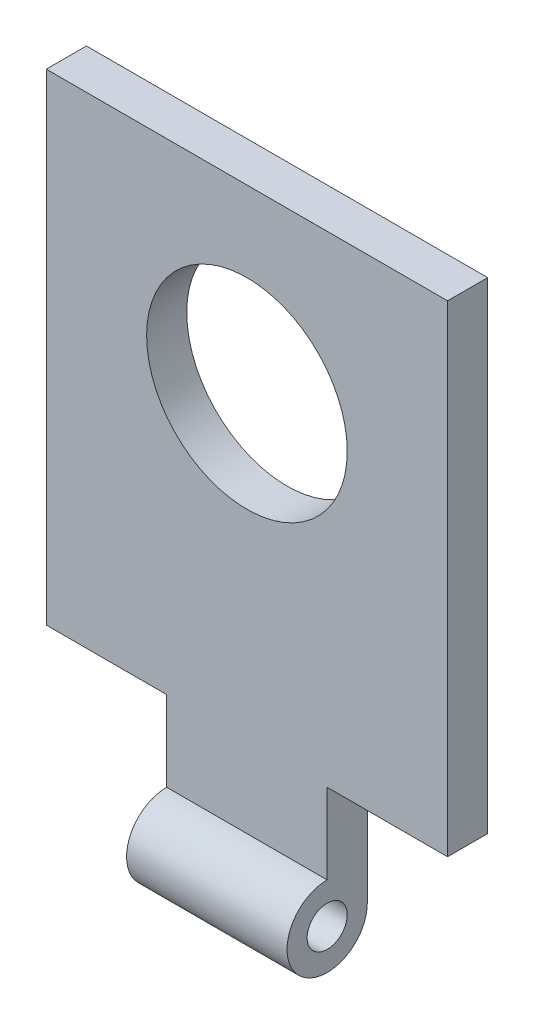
SolidWorks part; units mm, degrees
ref_plane "Plan de face" through (0, 0, 0) normal (0, 0, 1) x (1, 0, 0)
ref_plane "Plan de dessus" through (0, 0, 0) normal (0, 1, 0) x (1, 0, 0)
ref_plane "Plan de droite" through (0, 0, 0) normal (1, 0, 0) x (0, 0, -1)
sketch "Esquisse1" plane through (0, 0, 0) normal (0, 0, 1) x (1, 0, 0)
  line L0 (50, 0) -> (50, 150) construction
  line L1 (30, 0) -> (70, 0)
  line L2 (0, 30) -> (0, 150)
  line L3 (0, 150) -> (100, 150)
  line L4 (100, 30) -> (100, 150)
  line L7 (-9.5337, 105) -> (123.8236, 105) construction
  line L8 (30, 30) -> (30, 0)
  line L9 (30, 30) -> (0, 30)
  line L10 (70, 30) -> (70, 0)
  line L11 (70, 30) -> (100, 30)
  circle A0 centre (50, 105) radius 25
  dimension "D1" = 50
  dimension "D2" = 100
  dimension "D3" = 30
  dimension "D4" = 120
  dimension "D5" = 75
  dimension "D6" = 20
extrude "Boss.-Extru.1" add sketch "Esquisse1" along normal blind 10
sketch "Esquisse2" plane through (30, 0, 0) normal (-1, 0, 0) x (0, 0, 1)
  circle A0 centre (10, 0) radius 10
extrude "Boss.-Extru.2" add sketch "Esquisse2" against normal up to surface (40 mm away)
sketch "Esquisse3" plane through (30, 0, 0) normal (-1, 0, 0) x (0, 0, 1)
  circle A0 centre (10, 0) radius 5
extrude "Enlèv. mat.-Extru.1" cut sketch "Esquisse3" against normal through all
